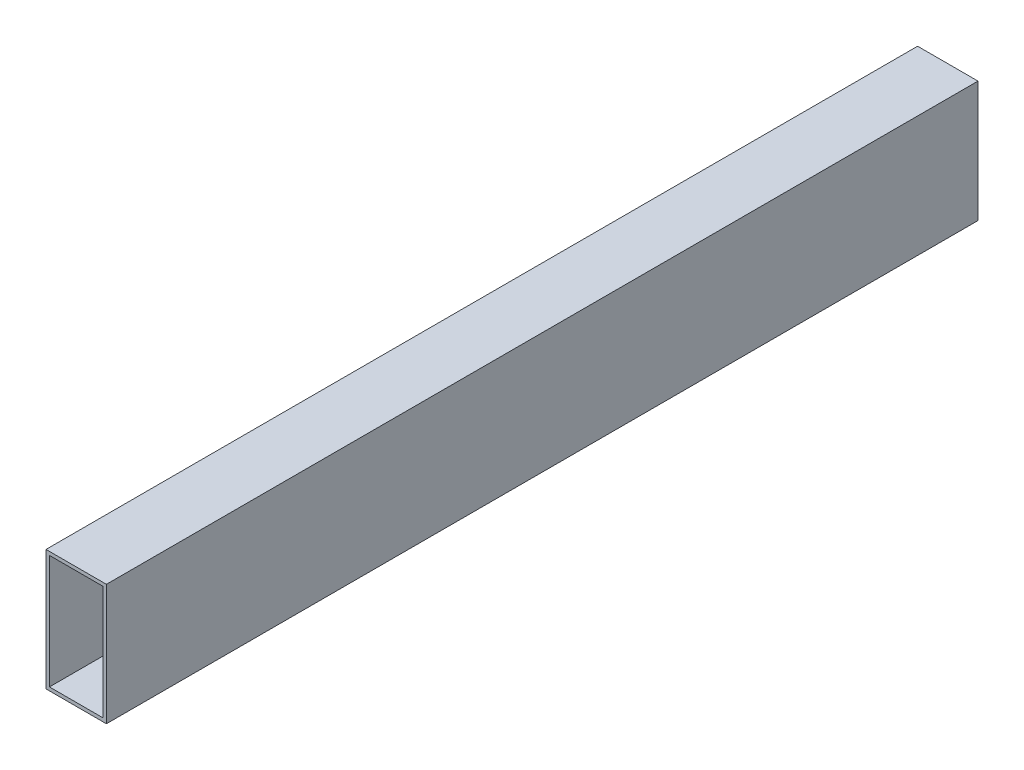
SolidWorks part; units mm, degrees
ref_plane "Front Plane" through (0, 0, 0) normal (0, 0, 1) x (1, 0, 0)
ref_plane "Top Plane" through (0, 0, 0) normal (0, 1, 0) x (1, 0, 0)
ref_plane "Right Plane" through (0, 0, 0) normal (1, 0, 0) x (0, 0, -1)
sketch "Sketch1" plane through (0, 0, 0) normal (0, 0, 1) x (1, 0, 0)
  line L0 (0, 140) -> (0, 0)
  line L1 (0, 0) -> (70, 0)
  line L2 (70, 0) -> (70, 140)
  line L3 (66, 136) -> (4, 136)
  line L4 (4, 136) -> (4, 4)
  line L5 (70, 140) -> (0, 140)
  line L6 (4, 4) -> (66, 4)
  line L7 (66, 4) -> (66, 136)
  dimension "D1" = 70
  dimension "D2" = 140
  dimension "D3" = 4
extrude "Boss-Extrude1" add sketch "Sketch1" along normal blind 1010
